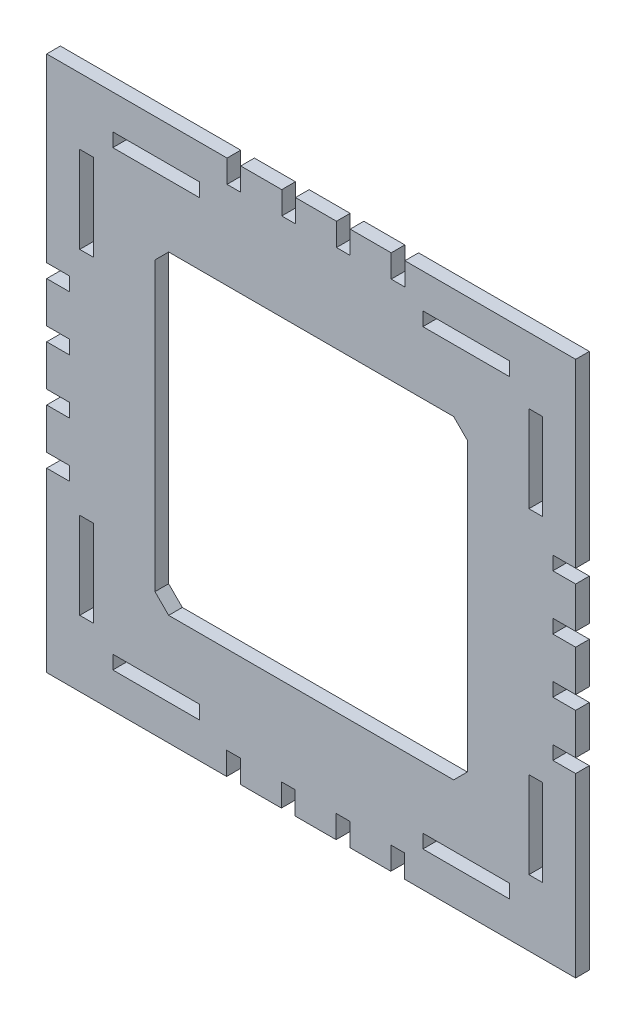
SolidWorks part; units mm, degrees
ref_plane "Alzado" through (0, 0, 0) normal (0, 0, 1) x (1, 0, 0)
ref_plane "Planta" through (0, 0, 0) normal (0, 1, 0) x (1, 0, 0)
ref_plane "Vista lateral" through (0, 0, 0) normal (1, 0, 0) x (0, 0, -1)
sketch "Sketch1" plane through (0, 0, 0) normal (0, 0, 1) x (1, 0, 0)
  line L0 (-31.25, 34.5) -> (-34.25, 31.5)
  line L1 (-58, -58.75) -> (58, -58.75)
  line L2 (-58, -58.75) -> (-58, 58.75)
  line L3 (-58, 58.75) -> (-18.4481, 58.75)
  line L4 (58, -58.75) -> (58, 58.75)
  line L5 (-58, -58.75) -> (58, 58.75) construction
  line L6 (-58, 58.75) -> (58, -58.75) construction
  line L7 (31.25, -34.5) -> (-31.25, -34.5)
  line L8 (34.25, -31.5) -> (34.25, 31.5)
  line L9 (31.25, 34.5) -> (-31.25, 34.5)
  line L10 (-34.25, -31.5) -> (-34.25, 31.5)
  line L11 (34.25, -34.5) -> (-34.25, 34.5) construction
  line L12 (34.25, 34.5) -> (-34.25, -34.5) construction
  line L13 (34.25, 31.5) -> (31.25, 34.5)
  line L14 (34.25, -31.5) -> (31.25, -34.5)
  line L15 (-31.25, -34.5) -> (-34.25, -31.5)
  line L16 (-15.4481, 58.75) -> (-6.4481, 58.75)
  line L17 (-24.5, 51.2) -> (-43.5, 51.2)
  line L18 (-24.5, 51.2) -> (-24.5, 48.2)
  line L19 (-24.5, 48.2) -> (-43.5, 48.2)
  line L20 (-43.5, 51.2) -> (-43.5, 48.2)
  line L21 (-24.5, 51.2) -> (-43.5, 48.2) construction
  line L22 (-24.5, 48.2) -> (-43.5, 51.2) construction
  line L23 (24.5, 51.2) -> (43.5, 51.2)
  line L24 (24.5, 51.2) -> (24.5, 48.2)
  line L25 (24.5, 48.2) -> (43.5, 48.2)
  line L26 (43.5, 51.2) -> (43.5, 48.2)
  line L27 (47.75, 44.25) -> (50.75, 44.25)
  line L28 (47.75, 44.25) -> (47.75, 25.25)
  line L29 (47.75, 25.25) -> (50.75, 25.25)
  line L30 (50.75, 44.25) -> (50.75, 25.25)
  line L31 (47.75, -25.25) -> (50.75, -25.25)
  line L32 (47.75, -25.25) -> (47.75, -44.25)
  line L33 (47.75, -44.25) -> (50.75, -44.25)
  line L34 (50.75, -25.25) -> (50.75, -44.25)
  line L35 (43.5, -48) -> (24.5, -48)
  line L36 (43.5, -48) -> (43.5, -51)
  line L37 (43.5, -51) -> (24.5, -51)
  line L38 (24.5, -48) -> (24.5, -51)
  line L39 (-24.5, -48) -> (-43.5, -48)
  line L40 (-24.5, -48) -> (-24.5, -51)
  line L41 (-24.5, -51) -> (-43.5, -51)
  line L42 (-43.5, -48) -> (-43.5, -51)
  line L43 (-47.75, -44.25) -> (-50.75, -44.25)
  line L44 (-47.75, -44.25) -> (-47.75, -25.25)
  line L45 (-47.75, -25.25) -> (-50.75, -25.25)
  line L46 (-50.75, -44.25) -> (-50.75, -25.25)
  line L47 (-47.75, 25.25) -> (-50.75, 25.25)
  line L48 (-47.75, 25.25) -> (-47.75, 44.25)
  line L49 (-47.75, 44.25) -> (-50.75, 44.25)
  line L50 (-50.75, 25.25) -> (-50.75, 44.25)
  line L52 (17.5519, 58.75) -> (17.5519, 53.75)
  line L53 (17.5519, 53.75) -> (20.5519, 53.75)
  line L54 (20.5519, 58.75) -> (20.5519, 53.75)
  line L56 (5.5519, 58.75) -> (5.5519, 53.75)
  line L57 (5.5519, 53.75) -> (8.5519, 53.75)
  line L58 (8.5519, 58.75) -> (8.5519, 53.75)
  line L60 (-6.4481, 58.75) -> (-6.4481, 53.75)
  line L61 (-6.4481, 53.75) -> (-3.4481, 53.75)
  line L62 (-3.4481, 58.75) -> (-3.4481, 53.75)
  line L64 (-18.4481, 58.75) -> (-18.4481, 53.75)
  line L65 (-18.4481, 53.75) -> (-15.4481, 53.75)
  line L66 (-15.4481, 58.75) -> (-15.4481, 53.75)
  line L67 (-3.4481, 58.75) -> (5.5519, 58.75)
  line L68 (8.5519, 58.75) -> (17.5519, 58.75)
  line L69 (20.5519, 58.75) -> (58, 58.75)
  line L71 (-18.5332, -58.75) -> (-15.5332, -58.75)
  line L72 (-18.5332, -58.75) -> (-18.5332, -53.75)
  line L73 (-18.5332, -53.75) -> (-15.5332, -53.75)
  line L74 (-15.5332, -58.75) -> (-15.5332, -53.75)
  line L75 (-3.5332, -53.75) -> (-6.5332, -53.75)
  line L76 (-3.5332, -53.75) -> (-3.5332, -58.75)
  line L77 (-3.5332, -58.75) -> (-6.5332, -58.75)
  line L78 (-6.5332, -53.75) -> (-6.5332, -58.75)
  line L79 (5.4668, -53.75) -> (8.4668, -53.75)
  line L80 (5.4668, -53.75) -> (5.4668, -58.75)
  line L81 (5.4668, -58.75) -> (8.4668, -58.75)
  line L82 (8.4668, -53.75) -> (8.4668, -58.75)
  line L83 (20.4668, -53.75) -> (17.4668, -53.75)
  line L84 (20.4668, -53.75) -> (20.4668, -58.75)
  line L85 (20.4668, -58.75) -> (17.4668, -58.75)
  line L86 (17.4668, -53.75) -> (17.4668, -58.75)
  line L91 (-58, 19.0773) -> (-53, 19.0773)
  line L92 (-58, 19.0773) -> (-58, 16.0773)
  line L93 (-58, 16.0773) -> (-53, 16.0773)
  line L94 (-53, 19.0773) -> (-53, 16.0773)
  line L95 (-58, 7.0773) -> (-53, 7.0773)
  line L96 (-58, 7.0773) -> (-58, 4.0773)
  line L97 (-58, 4.0773) -> (-53, 4.0773)
  line L98 (-53, 7.0773) -> (-53, 4.0773)
  line L99 (-58, -4.9227) -> (-53, -4.9227)
  line L100 (-58, -4.9227) -> (-58, -7.9227)
  line L101 (-58, -7.9227) -> (-53, -7.9227)
  line L102 (-53, -4.9227) -> (-53, -7.9227)
  line L103 (-58, -16.9227) -> (-53, -16.9227)
  line L104 (-58, -16.9227) -> (-58, -19.9227)
  line L105 (-58, -19.9227) -> (-53, -19.9227)
  line L106 (-53, -16.9227) -> (-53, -19.9227)
  line L107 (58, 19.0773) -> (53, 19.0773)
  line L108 (58, 19.0773) -> (58, 16.0773)
  line L109 (58, 16.0773) -> (53, 16.0773)
  line L110 (53, 19.0773) -> (53, 16.0773)
  line L111 (58, 4.0773) -> (53, 4.0773)
  line L112 (58, 4.0773) -> (58, 7.0773)
  line L113 (58, 7.0773) -> (53, 7.0773)
  line L114 (53, 4.0773) -> (53, 7.0773)
  line L116 (58, 0) -> (58, -3)
  line L120 (58, -12) -> (58, -15)
  line L123 (58, -4.9227) -> (53, -4.9227)
  line L124 (58, -4.9227) -> (58, -7.9227)
  line L125 (58, -7.9227) -> (53, -7.9227)
  line L126 (53, -4.9227) -> (53, -7.9227)
  line L127 (58, -16.9227) -> (53, -16.9227)
  line L128 (58, -16.9227) -> (58, -19.9227)
  line L129 (58, -19.9227) -> (53, -19.9227)
  line L130 (53, -16.9227) -> (53, -19.9227)
  point P0 (0, 0)
  point P6 (0, 0)
  point P19 (-34, 49.7)
  point P40 (43.5, -49.5)
  point P121 (53, -18.4227)
  dimension "D1" = 116
  dimension "D2" = 117.5
  dimension "D3" = 69
  dimension "D4" = 68.5
  dimension "D5" = 3
  dimension "D6" = 19
  dimension "D11" = 13.7
  dimension "D12" = 14.5
  dimension "D13" = 19
  dimension "D14" = 3
  dimension "D15" = 14.5
  dimension "D16" = 13.7
  dimension "D17" = 13.5
  dimension "D18" = 3
  dimension "D19" = 19
  dimension "D20" = 14.5
  dimension "D21" = 3
  dimension "D22" = 19
  dimension "D23" = 13.5
  dimension "D24" = 14.5
  dimension "D25" = 3
  dimension "D26" = 19
  dimension "D27" = 14.5
  dimension "D28" = 13.5
  dimension "D29" = 19
  dimension "D30" = 3
  dimension "D31" = 14.5
  dimension "D32" = 13.5
  dimension "D33" = 3
  dimension "D34" = 13.5
  dimension "D35" = 14.5
  dimension "D36" = 19
  dimension "D37" = 19
  dimension "D38" = 14.5
  dimension "D39" = 13.5
  dimension "D40" = 7.25
  dimension "D41" = 5
  dimension "D42" = 9
  dimension "D43" = 3
  dimension "D44" = 9
  dimension "D45" = 3
  dimension "D46" = 9
  dimension "D47" = 3
  dimension "D48" = 6.5672
  dimension "D49" = 5
  dimension "D50" = 3
  dimension "D51" = 16.1507
  dimension "D52" = 28.0642
  dimension "D53" = 5
  dimension "D54" = 3
  dimension "D55" = 6.57
  dimension "D56" = 9
  dimension "D57" = 3
  dimension "D58" = 5
  dimension "D59" = 3
  dimension "D60" = 5
  dimension "D61" = 3
  dimension "D62" = 3
  dimension "D63" = 5
  dimension "D64" = 5
  dimension "D65" = 6.57
  dimension "D66" = 9
  dimension "D67" = 9
  dimension "D68" = 3
  dimension "D69" = 3
  dimension "D70" = 3
  dimension "D71" = 5
  dimension "D72" = 5
  dimension "D73" = 5
  dimension "D74" = 9
  dimension "D75" = 9
  dimension "D76" = 9
  dimension "D77" = 3
  dimension "D78" = 6.57
  dimension "D79" = 5
  dimension "D80" = 9
  dimension "D81" = 3
  dimension "D82" = 9
  dimension "D83" = 5
  dimension "D84" = 9
  dimension "D85" = 3
  dimension "D86" = 3
  dimension "D87" = 5
  dimension "D88" = 5
extrude "Boss-Extrude1" add sketch "Sketch1" along normal blind 3 contours L130 L127 L4 L125 L126 L123 L111 L114 L113 L109 L110 L107 L69 L54 L53 L52 L68 L58 L57 L56 L67 L62 L61 L60 L16 L66 L65 L64 L3 L2 L91 L94 L93 L95 L98 L97 L99 L102 L101 L103 L106
